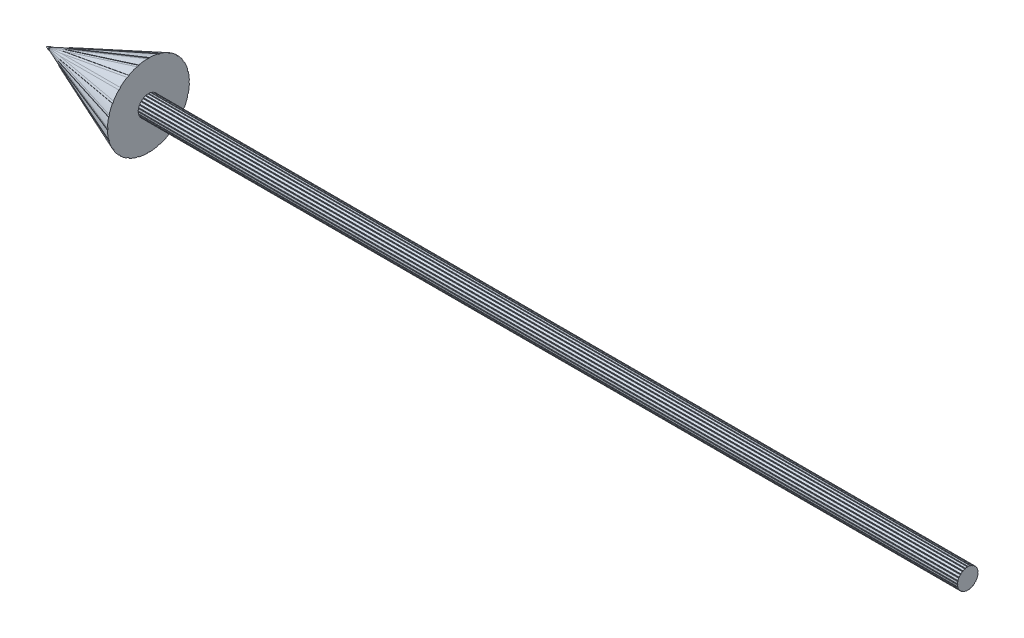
SolidWorks part; units mm, degrees
ref_plane "Face" through (0, 0, 0) normal (0, 0, 1) x (1, 0, 0)
ref_plane "Dessus" through (0, 0, 0) normal (0, 1, 0) x (1, 0, 0)
ref_plane "Droite" through (0, 0, 0) normal (1, 0, 0) x (0, 0, -1)
sketch "Esquisse1" plane through (0, 0, 0) normal (1, 0, 0) x (0, 0, -1)
  circle A0 centre (0, 0) radius 0.5
  dimension "D1" = 1
extrude "Boss.-Extru.1" add sketch "Esquisse1" along normal blind 40
sketch "Esquisse2" plane through (0, 0, 0) normal (0, 0, 1) x (1, 0, 0)
  line L0 (0, 0) -> (-11.2925, 0) construction
  line L1 (0, 0) -> (0, 2)
  line L2 (0, 2) -> (-5, 0)
  line L3 (-5, 0) -> (0, 0)
  dimension "D1" = 5
  dimension "D2" = 4
revolve "Révolution1" add sketch "Esquisse2" angle 360 about L0
sketch "Esquisse3" plane through (40, 0, 0) normal (1, 0, 0) x (0, 0, -1)
  line L0 (0, 0.48) -> (-0.05, 0.53)
  line L1 (-0.05, 0.53) -> (0.05, 0.53)
  line L2 (0.05, 0.53) -> (0, 0.48)
  line L3 (0, 0) -> (0, 0.48) construction
  dimension "D1" = 0.1
  dimension "D2" = 0.48
  dimension "D3" = 90
extrude "Enlèv. mat.-Extru.1" cut sketch "Esquisse3" against normal up to surface (40 mm away)
pattern_circular "Répétition circulaire1" count 24 over 360 about axis through (0, 0, 0) along (1, 0, 0) of "Enlèv. mat.-Extru.1"
sketch "Esquisse4" plane through (0, 0, 0) normal (0, 0, 1) x (1, 0, 0)
  line L0 (0, 1.9785) -> (-4.7721, 0.0696)
  line L1 (-4.7721, 0.0696) -> (-4.826, 0.0696)
  line L2 (0, 2) -> (-5, 0) construction
  line L3 (-4.826, 0.0696) -> (0, 2)
  line L4 (0, 2) -> (0, 1.9785)
  line L8 (0, 0.0196) -> (-6.1417, 0.0196) construction
  dimension "D1" = 0.02
  dimension "D2" = 0.05
extrude "Enlèv. mat.-Extru.2" cut sketch "Esquisse4" against normal mid plane 0.1
pattern_circular "Répétition circulaire2" count 24 over 360 about axis through (0, 0, 0) along (1, 0, 0) of "Enlèv. mat.-Extru.2"
ref_point "Point1"
